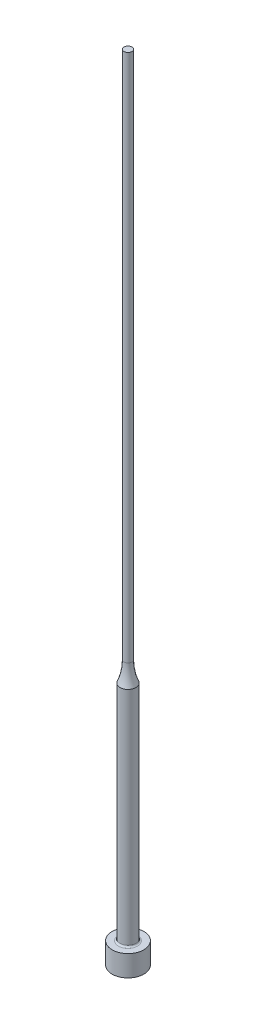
SolidWorks part; units mm, degrees
ref_plane "Front Plane" through (0, 0, 0) normal (0, 0, 1) x (1, 0, 0)
ref_plane "Top Plane" through (0, 0, 0) normal (0, 1, 0) x (1, 0, 0)
ref_plane "Right Plane" through (0, 0, 0) normal (1, 0, 0) x (0, 0, -1)
sketch "Sketch1" plane through (0, 0, 0) normal (0, 0, 1) x (1, 0, 0)
  line L0 (0, 0) -> (3, 0)
  line L1 (55, 0) -> (-55, 0) construction
  line L2 (3, 0) -> (3, 4)
  line L3 (3, 4) -> (1.8, 4)
  line L4 (1.5, 4.3) -> (1.5, 46.2003)
  line L6 (0.75, 50) -> (0.75, 150)
  line L7 (0.75, 150) -> (0, 150)
  line L8 (0, 150) -> (0, 0)
  arc A0 (0.75, 50) -> (1.5, 46.2003) centre (10.75, 50) ccw
  arc A1 (1.8, 4) -> (1.5, 4.3) centre (1.8, 4.3) cw
  dimension "D7" = 50
  dimension "D8" = 0.3
  dimension "D5" = 10
  dimension "D1" = 0.75
  dimension "D2" = 1.5
  dimension "D3" = 3
  dimension "D4" = 4
  dimension "D6" = 150
revolve "Revolve1" add sketch "Sketch1" angle 360 about L8
